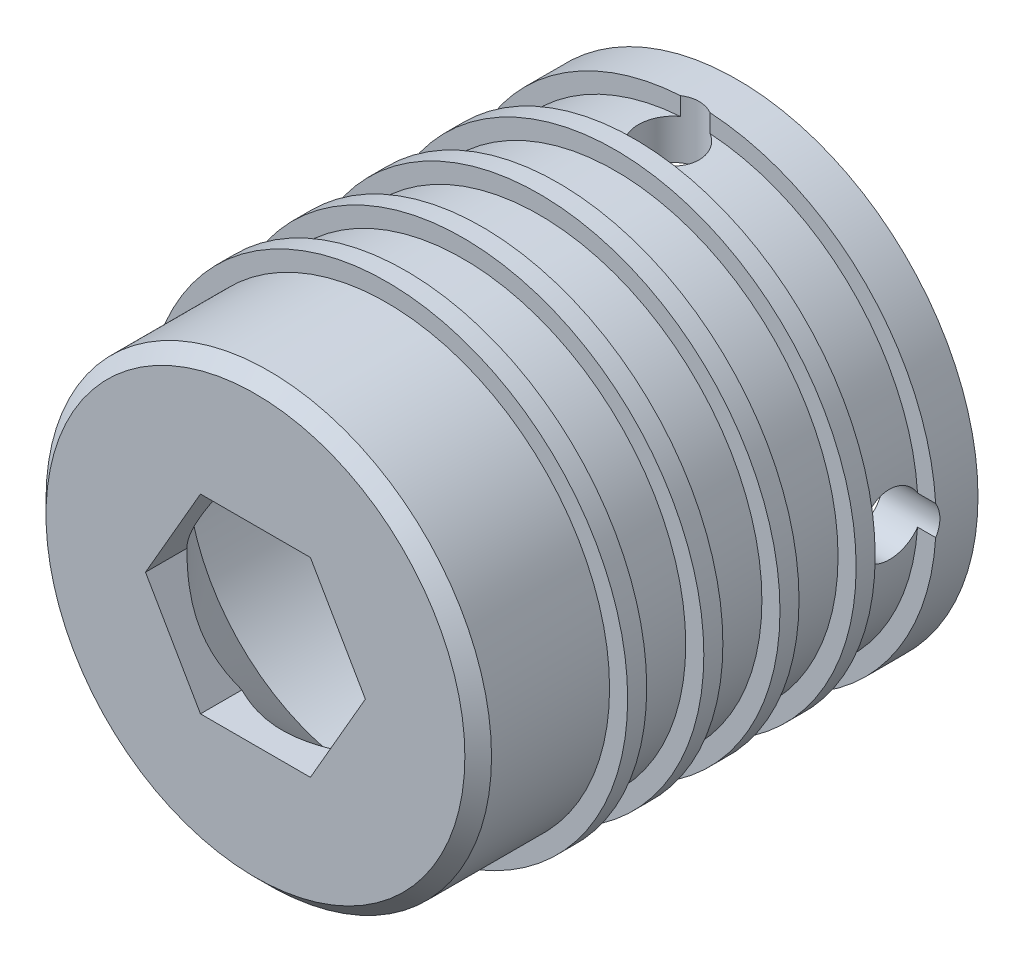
SolidWorks part; units mm, degrees
ref_plane "Front Plane" through (0, 0, 0) normal (0, 0, 1) x (1, 0, 0)
ref_plane "Top Plane" through (0, 0, 0) normal (0, 1, 0) x (1, 0, 0)
ref_plane "Right Plane" through (0, 0, 0) normal (1, 0, 0) x (0, 0, -1)
sketch "Sketch1" plane through (0, 0, 0) normal (0, 0, 1) x (1, 0, 0)
  circle A0 centre (0, 0) radius 6.325
  dimension "D1" = 12.65
extrude "Boss-Extrude1" add sketch "Sketch1" along normal blind 12.65
sketch "Sketch2" plane through (0, 0, 0) normal (0, 0, -1) x (-1, 0, 0)
  circle A0 centre (0, 0) radius 4.8
  dimension "D1" = 9.6
extrude "Cut-Extrude1" cut sketch "Sketch2" against normal blind 9.65
sketch "Sketch3" plane through (0, 0, 9.65) normal (0, 0, -1) x (-1, 0, 0)
  circle A0 centre (0, 0) radius 2.45
  dimension "D1" = 4.9
extrude "Cut-Extrude2" [suppressed] cut sketch "Sketch3" against normal through all
sketch "Sketch4" plane through (0, 0, 9.65) normal (0, 0, -1) x (-1, 0, 0)
  circle A0 centre (0, 0) radius 4.8
  circle A1 centre (0, 0) radius 4.8 construction
extrude "Cut-Extrude3" cut sketch "Sketch4" against normal through all draft 45
sketch "Sketch5" plane through (0, 0, 12.65) normal (0, 0, 1) x (1, 0, 0)
  line L0 (0, 0) -> (0, 6.325) construction
  line L1 (0, 0) -> (0.4412, 6.3096) construction
  line L2 (0, 6.325) -> (0.2129, 6.0967)
  line L3 (0.2129, 6.0967) -> (0.4412, 6.3096)
  circle A0 centre (0, 0) radius 6.325 construction
  arc A1 (0, 6.325) -> (0.4412, 6.3096) centre (0.2283, 6.5379) cw
  dimension "D1" = 4
extrude "Cut-Extrude4" [suppressed] cut sketch "Sketch5" against normal blind 4.2
pattern_circular "CirPattern1" [suppressed] count 90 over 360
chamfer "Chamfer1" distance 0.5 angle 45 1 edges at (-4.8, 0, 0)
sketch "Sketch6" plane through (0, 0, 0) normal (1, 0, 0) x (0, 0, -1)
  circle A0 centre (-1.8, 0) radius 0.8
  point P2 (-1, 0)
  dimension "D2" = 1.6
  dimension "D1" = 1
extrude "Cut-Extrude5" cut sketch "Sketch6" against normal through all both and the other way through all
pattern_circular "CirPattern2" count 2 over 90 about axis through (0, 0, 12.65) along (0, 0, -1) of "Cut-Extrude5"
sketch "Sketch7" plane through (0, 0, 0) normal (1, 0, 0) x (0, 0, -1)
  line L0 (0, -6.325) -> (0, 6.325) construction
  circle A0 centre (-1.8, 4.8) radius 0.8
  dimension "D1" = 1.6
  dimension "D2" = 1.8
  dimension "D3" = 4.8
revolve "Cut-Revolve1" [suppressed] cut sketch "Sketch7" angle 360
sketch "Sketch8" plane through (0, 0, 0) normal (1, 0, 0) x (0, 0, -1)
  line L0 (-2.6, 6.325) -> (-12.65, 6.325) construction
  line L1 (-2.7, 6.325) -> (-1.1, 6.325)
  line L2 (-2.7, 6.325) -> (-2.7, 5.85)
  line L3 (-2.7, 5.85) -> (-1.1, 5.85)
  line L4 (-1.1, 6.325) -> (-1.1, 5.85)
  line L6 (-3.2, 6.325) -> (-4.7, 6.325)
  line L7 (-3.2, 6.325) -> (-3.2, 5.85)
  line L8 (-3.2, 5.85) -> (-4.7, 5.85)
  line L9 (-4.7, 6.325) -> (-4.7, 5.85)
  line L10 (-5.2, 6.325) -> (-6.7, 6.325)
  line L11 (-5.2, 6.325) -> (-5.2, 5.85)
  line L12 (-5.2, 5.85) -> (-6.7, 5.85)
  line L13 (-6.7, 6.325) -> (-6.7, 5.85)
  line L19 (-2.6, 6.325) -> (-12.65, 6.325) construction
  line L24 (-8.7, 6.325) -> (-7.2, 6.325)
  line L25 (-8.7, 6.325) -> (-8.7, 5.85)
  line L26 (-8.7, 5.85) -> (-7.2, 5.85)
  line L27 (-7.2, 6.325) -> (-7.2, 5.85)
  line L28 (0, -6.325) -> (0, 6.325) construction
  line L29 (-9.2, 6.325) -> (-14.2, 6.325)
  line L30 (-9.2, 6.325) -> (-9.2, 5.85)
  line L31 (-9.2, 5.85) -> (-14.2, 5.85)
  line L32 (-14.2, 6.325) -> (-14.2, 5.85)
  line L33 (-14.2, 5.85) -> (-14.2, 0) construction
  line L35 (-14.2, 0) -> (-14.2, -5.85) construction
  line L36 (-9.2, 6.325) -> (-8.7, 6.325) construction
  line L37 (-7.2, 6.325) -> (-6.7, 6.325) construction
  line L38 (-5.2, 6.325) -> (-4.7, 6.325) construction
  line L39 (-3.2, 6.325) -> (-2.7, 6.325) construction
  dimension "D1" = 1.1
  dimension "D2" = 1.6
  dimension "D3" = 9.2
  dimension "D4" = 5
  dimension "D5" = 11.7
  dimension "D6" = 0.5
revolve "Cut-Revolve3" cut sketch "Sketch8" angle 360 about axis through (0, 0, 9.65) along (0, 0, -1)
sketch "Sketch9" plane through (0, 0, 12.65) normal (0, 0, 1) x (1, 0, 0)
  line L1 (1.4434, 2.5) -> (-1.4434, 2.5)
  line L2 (-1.4434, 2.5) -> (-2.8868, 0)
  line L3 (-2.8868, 0) -> (-1.4434, -2.5)
  line L4 (-1.4434, -2.5) -> (1.4434, -2.5)
  line L5 (1.4434, -2.5) -> (2.8868, 0)
  line L6 (2.8868, 0) -> (1.4434, 2.5)
  circle A0 centre (0, 0) radius 2.5 construction
  dimension "D1" = 5
extrude "Cut-Extrude6" cut sketch "Sketch9" against normal blind 10
sketch "Sketch10" plane through (0, 0, 12.65) normal (0, 0, 1) x (1, 0, 0)
  circle A0 centre (0, 0) radius 5.5
  dimension "D1" = 11
extrude "Cut-Extrude7" cut sketch "Sketch10" against normal through all draft 45 flip side to cut
